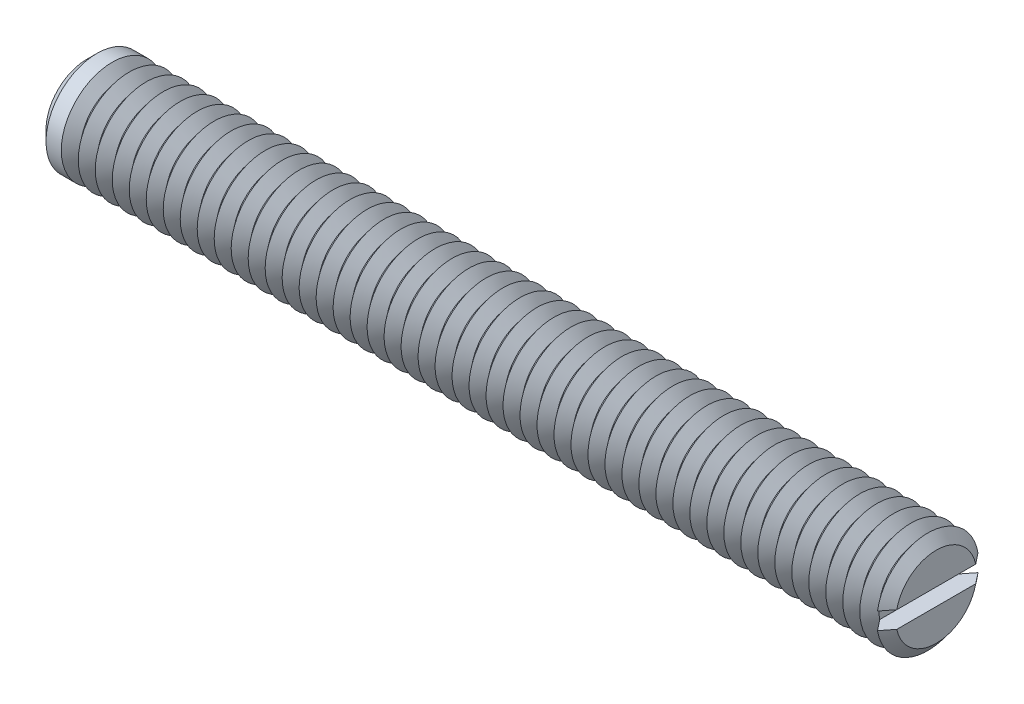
SolidWorks part; units mm, degrees
ref_plane "Front Plane" through (0, 0, 0) normal (0, 0, 1) x (1, 0, 0)
ref_plane "Top Plane" through (0, 0, 0) normal (0, 1, 0) x (1, 0, 0)
ref_plane "Right Plane" through (0, 0, 0) normal (1, 0, 0) x (0, 0, -1)
sketch "Sketch1" plane through (0, 0, 0) normal (1, 0, 0) x (0, 0, -1)
  circle A0 centre (0, 0) radius 3
  dimension "D1" = 6
extrude "Extrude1" add sketch "Sketch1" along normal mid plane 50
sketch "Sketch2" plane through (0, 0, 0) normal (0, 0, 1) x (1, 0, 0)
  line L0 (25, 0.5) -> (24, 0.5)
  line L1 (25, -3) -> (25, 3) construction
  line L2 (24, 0.5) -> (24, -0.5)
  line L3 (0, 0) -> (50000, 0) construction
  line L4 (25, -0.5) -> (24, -0.5)
  line L5 (25, -0.5) -> (25, 0.5)
  point P9 (24, 0)
  dimension "D1" = 1
extrude "Extrude2" cut sketch "Sketch2" against normal mid plane 9
chamfer "Chamfer1" distance 0.6 angle 45 1 edges at (-25, 0, -3)
sketch "Sketch3" plane through (0, 0, 0) normal (0, 0, 1) x (1, 0, 0)
  line L0 (0, 0) -> (30.9602, 0) construction
  line L1 (24.5, -3) -> (25.5, -3)
  line L2 (-24.4, -3) -> (25, -3) construction
  line L3 (25.5, -3) -> (25, -2.3755)
  line L4 (25, -3) -> (25, -0.5) construction
  line L5 (25, -2.3755) -> (24.5, -3)
  dimension "D1" = 1
  dimension "D2" = 0.8
revolve "Cut-Revolve1" cut sketch "Sketch3" angle 360 about L0
pattern_linear "LPattern1" count 49 spacing 1 along (-1, 0, 0) of "Cut-Revolve1"
equation "\"D2@Sketch3\" = \"D1@Sketch3\"*0.8"
